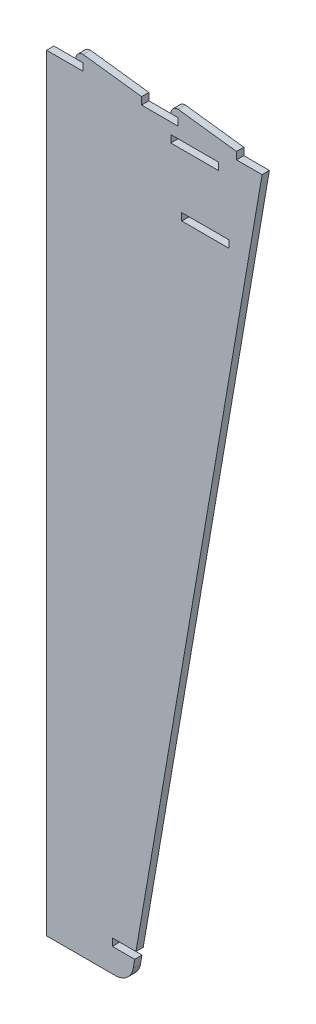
SolidWorks part; units mm, degrees
ref_plane "Front Plane" through (0, 0, 0) normal (0, 0, 1) x (1, 0, 0)
ref_plane "Top Plane" through (0, 0, 0) normal (0, 1, 0) x (1, 0, 0)
ref_plane "Right Plane" through (0, 0, 0) normal (1, 0, 0) x (0, 0, -1)
sketch "Sketch1" plane through (0, 0, 0) normal (0, 0, 1) x (1, 0, 0)
  line L8 (18.5, -18.25) -> (25.5, -18.25)
  line L9 (2.5, -14.25) -> (18.5, -16.25)
  line L10 (-23.5, -14.25) -> (-7.5, -16.25)
  line L11 (-23.5, -16.25) -> (-25.5, -16.25)
  line L13 (2.5, -18.25) -> (-7.5, -18.25)
  line L14 (-23.5, -18.25) -> (-33.5, -18.25)
  line L16 (-23.5, -18.25) -> (-23.5, -16.25)
  line L17 (-7.5, -18.25) -> (-7.5, -16.25)
  line L18 (2.5, -18.25) -> (2.5, -16.25)
  line L19 (2.5, -16.25) -> (0.5, -16.25)
  line L20 (18.5, -18.25) -> (18.5, -16.25)
  line L22 (-33.5, -18.25) -> (-33.5, -228.25)
  line L24 (-33.5, -228.25) -> (-10.5, -228.25)
  line L25 (-10.5, -228.25) -> (25.5, -18.25)
  arc A4 (2.5, -14.25) -> (0.5, -16.25) centre (2.5, -16.25) ccw
  arc A5 (-23.5, -14.25) -> (-25.5, -16.25) centre (-23.5, -16.25) ccw
  dimension "D12" = 2
  dimension "D1" = 2
  dimension "D2" = 7
  dimension "D3" = 18.25
  dimension "D4" = 2
  dimension "D5" = 210
  dimension "D6" = 59
  dimension "D7" = 10
  dimension "D8" = 18.5
  dimension "D9" = 7.5
  dimension "D10" = 14.25
  dimension "D11" = 2
  dimension "D13" = 23
extrude "Boss-Extrude1" add sketch "Sketch1" along normal blind 2
fillet "Fillet2" radius 5 1 edges at (-10.5, -228.25, 1)
other "Cavity1"
other "veryToptop<1>@body1"
other "Cavity2"
other "micH<2>@body1"
other "micH<1>@body1"
equation "\"anch\" = 2"
equation "\"alt\" = 100"
equation "\"pilanch\" = 100"
equation "\"pilalt\" = 250"
equation "\"bodyHeigh\" = 60"
equation "\"dorsalFinHeigh\" = 400"
